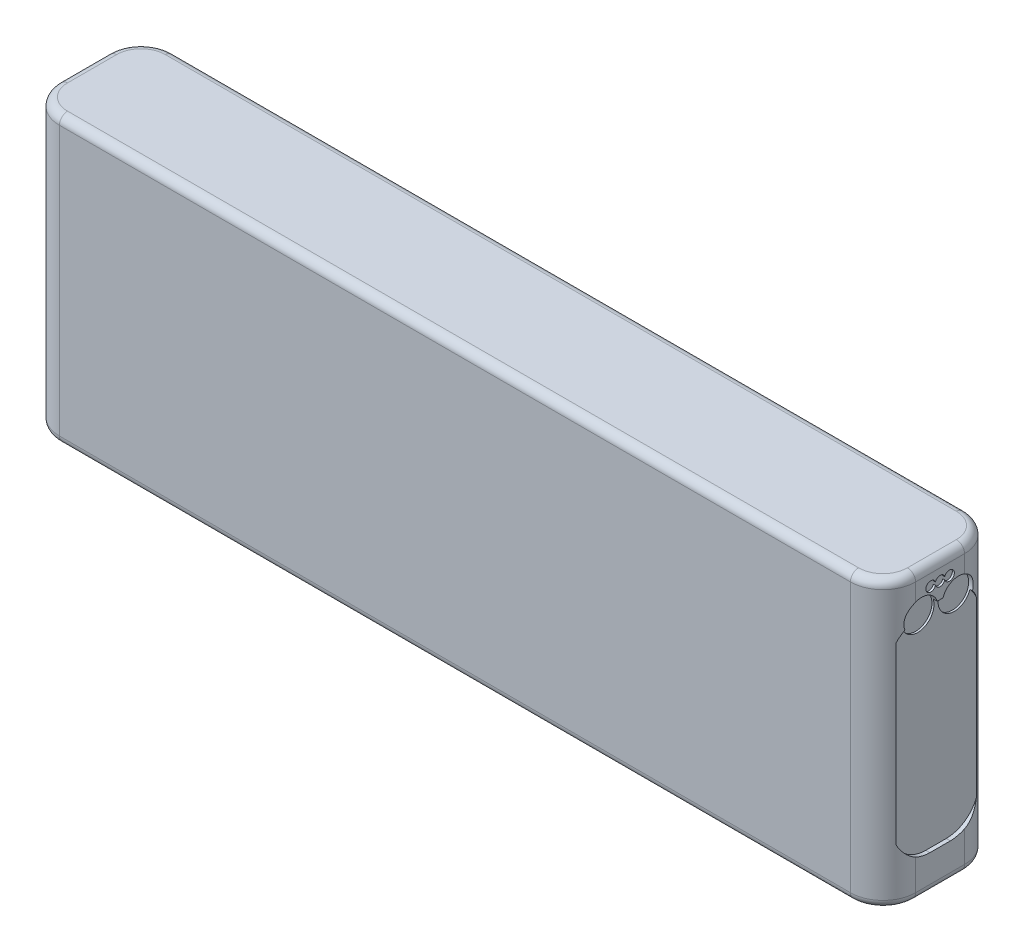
SolidWorks part; units mm, degrees
ref_plane "Front Plane" through (0, 0, 0) normal (0, 0, 1) x (1, 0, 0)
ref_plane "Top Plane" through (0, 0, 0) normal (0, 1, 0) x (1, 0, 0)
ref_plane "Right Plane" through (0, 0, 0) normal (1, 0, 0) x (0, 0, -1)
ref_plane "Plane1" through (0, 0, -15) normal (0, 0, -1) x (-1, 0, 0)
sketch "Sketch1" plane through (0, 0, -15) normal (0, 0, -1) x (-1, 0, 0)
  line L0 (-52.5, -17.5) -> (52.5, -17.5)
  line L1 (52.5, -17.5) -> (52.5, 17.5)
  line L2 (52.5, 17.5) -> (-52.5, 17.5)
  line L3 (-52.5, 17.5) -> (-52.5, -17.5)
  line L4 (-52.5, 0) -> (52.5, 0) construction
  line L5 (0, 17.5) -> (0, -17.5) construction
  dimension "D1" = 35
  dimension "D2" = 105
extrude "Boss-Extrude1" add sketch "Sketch1" against normal blind 14
sketch "Sketch2" plane through (52.5, 0, 0) normal (1, 0, 0) x (0, 0, -1)
  line L0 (2.75, 9.125) -> (2.75, -9.125)
  line L1 (6.75, -13.125) -> (9.25, -13.125)
  line L2 (13.25, -9.125) -> (13.25, 9.125)
  line L3 (9.25, 13.125) -> (6.75, 13.125)
  line L4 (1, 17.5) -> (15, -17.5) construction
  line L5 (15, 17.5) -> (1, -17.5) construction
  line L6 (2.75, 13.125) -> (13.25, -13.125) construction
  line L7 (13.25, 13.125) -> (2.75, -13.125) construction
  line L12 (1, 17.5) -> (15, 17.5) construction
  line L13 (1, 17.5) -> (1, -17.5) construction
  line L14 (1, -17.5) -> (15, -17.5) construction
  line L15 (15, 17.5) -> (15, -17.5) construction
  line L16 (1, 17.5) -> (15, -17.5) construction
  line L17 (1, -17.5) -> (15, 17.5) construction
  arc A0 (2.75, -9.125) -> (6.75, -13.125) centre (6.75, -9.125) ccw
  arc A1 (9.25, -13.125) -> (13.25, -9.125) centre (9.25, -9.125) ccw
  arc A2 (13.25, 9.125) -> (9.25, 13.125) centre (9.25, 9.125) ccw
  arc A3 (2.75, 9.125) -> (6.75, 13.125) centre (6.75, 9.125) cw
  point P16 (8, 0)
  dimension "D3" = 4
  dimension "D1" = 10.5
  dimension "D2" = 14
extrude "Cut-Extrude1" cut sketch "Sketch2" against normal blind 0.5
sketch "Sketch3" plane through (-52.5, 0, 0) normal (-1, 0, 0) x (0, 0, 1)
  line L0 (-6.75, 13.125) -> (-9.25, 13.125)
  line L1 (-13.25, 9.125) -> (-13.25, -9.125)
  line L2 (-9.25, -13.125) -> (-6.75, -13.125)
  line L3 (-2.75, -9.125) -> (-2.75, 9.125)
  line L4 (-13.25, 13.125) -> (-2.75, -13.125) construction
  line L5 (-2.75, 13.125) -> (-13.25, -13.125) construction
  line L6 (-15, 17.5) -> (-1, -17.5) construction
  line L7 (-1, -17.5) -> (-15, -17.5) construction
  line L8 (-15, -17.5) -> (-1, 17.5) construction
  arc A0 (-13.25, -9.125) -> (-9.25, -13.125) centre (-9.25, -9.125) ccw
  arc A1 (-6.75, -13.125) -> (-2.75, -9.125) centre (-6.75, -9.125) ccw
  arc A2 (-6.75, 13.125) -> (-2.75, 9.125) centre (-6.75, 9.125) cw
  arc A3 (-9.25, 13.125) -> (-13.25, 9.125) centre (-9.25, 9.125) ccw
  dimension "D3" = 4
  dimension "D1" = 10.5
  dimension "D2" = 14
extrude "Cut-Extrude2" cut sketch "Sketch3" against normal blind 0.5
fillet "Fillet1" radius 4 4 edges at (-52.5, 0, -15) (-52.5, 0, -1) (52.5, 0, -15) (52.5, 0, -1)
fillet "Fillet2" radius 1 16 edges at (51.3284, 17.5, -13.8284) (52.5, 17.5, -8) (0, 17.5, -15) (51.3284, 17.5, -2.1716) (-51.3284, 17.5, -13.8284) (0, 17.5, -1) (-52.5, 17.5, -8) (-51.3284, 17.5, -2.1716) (-52.5, -17.5, -8) (-51.3284, -17.5, -13.8284) (-51.3284, -17.5, -2.1716) (0, -17.5, -15) (0, -17.5, -1) (51.3284, -17.5, -13.8284) (51.3284, -17.5, -2.1716) (52.5, -17.5, -8)
sketch "Sketch4" plane through (0, 0, -1) normal (0, 0, 1) x (1, 0, 0)
  line L0 (-48.5, 0) -> (48.5, 0) construction
  line L1 (-48.5, 16.5) -> (-48.5, -16.5) construction
  line L2 (48.5, -16.5) -> (48.5, 16.5) construction
  line L3 (0, 25.9735) -> (0, -16.5) construction
  line L4 (-48.5, -16.5) -> (48.5, -16.5) construction
  circle A0 centre (0, 0) radius 0.5026
sketch "Esquisse1" plane through (52, 0, 0) normal (1, 0, 0) x (0, 0, -1)
  line L2 (5.75, 12.5) -> (10.25, 12.5) construction
  line L3 (5, 17.5) -> (11, 17.5) construction
  line L4 (5, 17.5) -> (11, 17.5) construction
  line L5 (8, 17.5) -> (8, 12.5) construction
  circle A0 centre (5.75, 12.5) radius 2
  circle A1 centre (10.25, 12.5) radius 2
  dimension "D1" = 4
  dimension "D2" = 5
  dimension "D3" = 4.5
extrude "Enlèv. mat.-Extru.1" cut sketch "Esquisse1" against normal blind 0.25 and the other way up to next
sketch "Esquisse2" plane through (52.5, 0, 0) normal (1, 0, 0) x (0, 0, -1)
  line L0 (6.85, 15.1) -> (8, 15.1) construction
  line L1 (8, 15.1) -> (9.15, 15.1) construction
  line L2 (5, 17.5) -> (11, 17.5) construction
  line L3 (5, 17.5) -> (11, 17.5) construction
  line L4 (8, 17.5) -> (8, 15.1) construction
  arc A0 (7.425, 14.9286) -> (8.575, 14.9286) centre (8, 15.1) ccw
  arc A1 (8.575, 14.9286) -> (8.575, 15.2714) centre (9.15, 15.1) ccw
  arc A2 (7.425, 15.2714) -> (7.425, 14.9286) centre (6.85, 15.1) ccw
  arc A3 (8.575, 15.2714) -> (7.425, 15.2714) centre (8, 15.1) ccw
  dimension "D1" = 1.2
  dimension "D2" = 2.4
  dimension "D3" = 1.15
  dimension "D4" = 1.15
extrude "Enlèv. mat.-Extru.4" cut sketch "Esquisse2" against normal blind 0.25 contours A1
equation "\"D1@Sketch3\"=\"D2@Sketch3\" * .75"
equation "\"D1@Sketch2\"=\"D2@Sketch2\"* .75"
